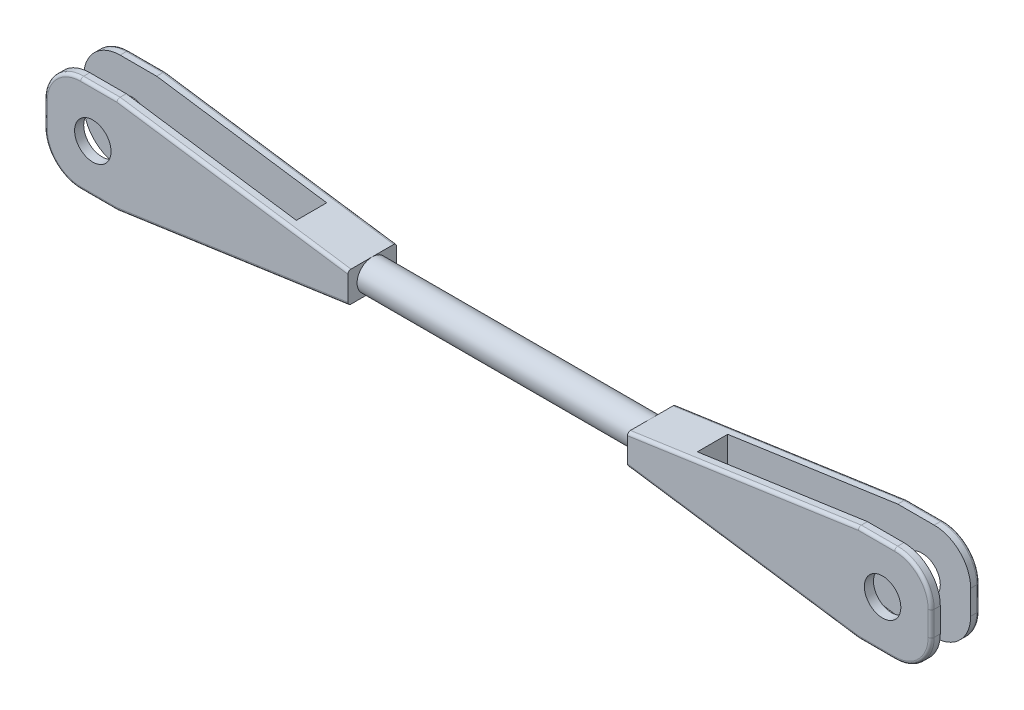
SolidWorks part; units mm, degrees
ref_plane "Plan de face" through (0, 0, 0) normal (0, 0, 1) x (1, 0, 0)
ref_plane "Plan de dessus" through (0, 0, 0) normal (0, 1, 0) x (1, 0, 0)
ref_plane "Plan de droite" through (0, 0, 0) normal (1, 0, 0) x (0, 0, -1)
sketch "Esquisse1" plane through (0, 0, 0) normal (0, 0, 1) x (1, 0, 0)
  line L0 (-80, 0) -> (-80, 80)
  line L1 (-80, 80) -> (40, 80)
  line L2 (420, 0) -> (420, 25)
  line L3 (420, 0) -> (-80, 0)
  line L4 (420, 25) -> (40, 80)
  dimension "D1" = 80
  dimension "D2" = 80
  dimension "D3" = 500
  dimension "D4" = 120
  dimension "D5" = 25
extrude "Boss.-Extru.1" add sketch "Esquisse1" along normal mid plane 80
mirror "Symétrie1" about plane through (0, 0, 0) normal (0, 1, 0) of "Boss.-Extru.1"
fillet "Congé1" radius 60 2 edges at (-80, -80, 0) (-80, 80, 0)
sketch "Esquisse2" plane through (0, 80, 0) normal (0, 1, 0) x (1, 0, 0)
  line L0 (-80, -40) -> (-80, 40) construction
  line L1 (-80, 0) -> (320, 0)
  line L2 (-80, 0) -> (-80, 25)
  line L3 (-80, 25) -> (320, 25)
  line L4 (320, 0) -> (320, 25)
  dimension "D1" = 25
  dimension "D2" = 400
extrude "Enlèv. mat.-Extru.1" cut sketch "Esquisse2" against normal through all
mirror "Symétrie2" about plane through (0, 0, 0) normal (0, 0, 1) of "Enlèv. mat.-Extru.1"
sketch "Esquisse3" plane through (0, 0, 40) normal (0, 0, 1) x (1, 0, 0)
  circle A0 centre (0, 0) radius 30
extrude "Enlèv. mat.-Extru.2" cut sketch "Esquisse3" against normal through all
sketch "Esquisse4" plane through (420, 0, 0) normal (1, 0, 0) x (0, 0, -1)
  circle A0 centre (0, 0) radius 25
extrude "Boss.-Extru.2" add sketch "Esquisse4" along normal blind 230
fillet "Congé6" radius 5 14 edges at (230, 52.5, 40) (10, 80, 40) (10, -80, 40) (230, -52.5, 40) (230, -52.5, -40) (10, -80, -40) (-80, 0, -40) (-62.4264, 62.4264, -40) (-62.4264, -62.4264, -40) (-80, 0, 40) (-62.4264, 62.4264, 40) (-62.4264, -62.4264, 40) (10, 80, -40) (230, 52.5, -40)
mirror "Symétrie4" about plane through (650, 0, 0) normal (1, 0, 0) of "Symétrie1", "Congé1", "Boss.-Extru.1", "Enlèv. mat.-Extru.1", "Symétrie2", "Enlèv. mat.-Extru.2", "Boss.-Extru.2", "Congé6"
